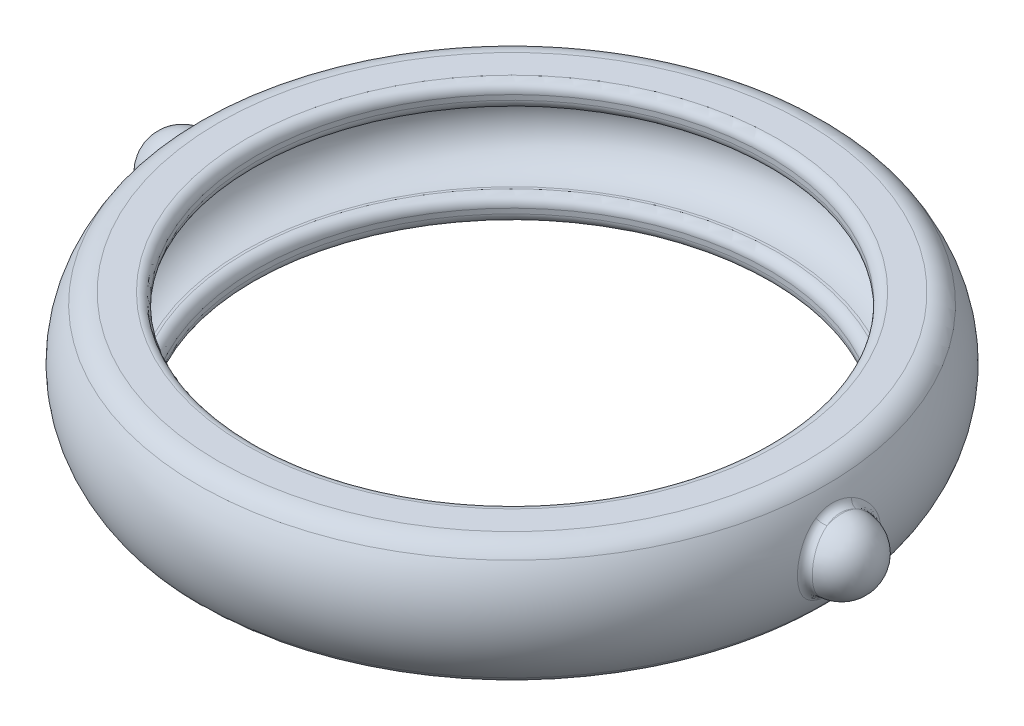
SolidWorks part; units mm, degrees
ref_plane "前视基准面" through (0, 0, 0) normal (0, 0, 1) x (1, 0, 0)
ref_plane "上视基准面" through (0, 0, 0) normal (0, 1, 0) x (1, 0, 0)
ref_plane "右视基准面" through (0, 0, 0) normal (1, 0, 0) x (0, 0, -1)
sketch "草图1" plane through (0, 0, 0) normal (0, 0, 1) x (1, 0, 0)
  line L0 (0, 18.5238) -> (0, -10.9048) construction
  line L2 (10.8, 0) -> (11.9292, 0)
  line L3 (10.4, 0.4) -> (10.4, 0.6)
  line L4 (10.8, 5) -> (11.9292, 5)
  line L6 (12.4, 5.7484) -> (12.4, -1.0538) construction
  line L7 (9.0947, 4) -> (12.7705, 4) construction
  line L8 (9.0947, 1) -> (12.7705, 1) construction
  line L9 (10.9, 5.6525) -> (10.9, -0.1978) construction
  line L10 (10.4, 4.4) -> (10.4, 4.6)
  line L11 (10.8, 4) -> (10.9, 4)
  line L12 (10.8, 1) -> (10.9, 1)
  arc A0 (10.9, 1) -> (10.9, 4) centre (10.9, 2.5) ccw
  arc A1 (12.7499, 4.5714) -> (12.7499, 0.4286) centre (9.775, 2.5) cw
  arc A2 (10.8, 0) -> (10.4, 0.4) centre (10.8, 0.4) cw
  arc A3 (10.4, 0.6) -> (10.8, 1) centre (10.8, 0.6) cw
  arc A4 (10.4, 4.4) -> (10.8, 4) centre (10.8, 4.4) ccw
  arc A5 (10.4, 4.6) -> (10.8, 5) centre (10.8, 4.6) cw
  arc A6 (12.7499, 0.4286) -> (11.9292, 0) centre (11.9292, 1) cw
  arc A7 (12.7499, 4.5714) -> (11.9292, 5) centre (11.9292, 4) ccw
  point P22 (10.4, 1)
  point P28 (10.4, 4)
  point P33 (12.4, 0)
  point P36 (12.4, 5)
  dimension "D3" = 1
  dimension "D1" = 13.4
  dimension "D2" = 0.4
  dimension "D4" = 0.5
revolve "旋转1" add sketch "草图1" angle 360 about L0
ref_plane "基准面1" through (13.4, 0, 0) normal (1, 0, 0) x (0, 0, -1)
sketch "草图4" plane through (13.4, 0, 0) normal (1, 0, 0) x (0, 0, -1)
  line L0 (-16.7, 2.5) -> (16.7, 2.5) construction
  line L1 (0, -2.5) -> (0, 2.5) construction
  line L2 (-13.4, 2.5) -> (13.4, 2.5) construction
  circle A0 centre (0, 2.5) radius 1.4
  arc A1 (-12.7499, 4.5714) -> (-12.7499, 0.4286) centre (-9.775, 2.5) ccw construction
  arc A2 (12.7499, 0.4286) -> (12.7499, 4.5714) centre (9.775, 2.5) ccw construction
  point P14 (0, 0)
  dimension "D1" = 2.8
  dimension "D2" = 0
extrude "凸台-拉伸1" add sketch "草图4" against normal up to next
sketch "草图5" plane through (13.4, 0, 0) normal (1, 0, 0) x (0, 0, -1)
  line L0 (0, 3.9) -> (0, 1.1)
  circle A0 centre (0, 2.5) radius 1.4 construction
  arc A1 (0, 1.1) -> (0, 3.9) centre (0, 2.5) ccw
revolve "旋转2" add sketch "草图5" angle 180 about L0
ref_plane "基准面2" through (-13.4, 0, 0) normal (1, 0, 0) x (0, 0, -1)
sketch "草图6" plane through (-13.4, 0, 0) normal (1, 0, 0) x (0, 0, -1)
  circle A0 centre (0, 2.5) radius 1.4 construction
  circle A1 centre (0, 2.5) radius 1.4
extrude "凸台-拉伸2" add sketch "草图6" along normal up to next
sketch "草图7" plane through (-13.4, 0, 0) normal (-1, 0, 0) x (0, 0, 1)
  line L0 (0, 1.1) -> (0, 3.9)
  circle A0 centre (0, 2.5) radius 1.4 construction
  arc A1 (0, 1.1) -> (0, 3.9) centre (0, 2.5) ccw
revolve "旋转3" add sketch "草图7" angle 180 about L0
fillet "圆角1" radius 0.35 2 edges at (-13.1887, 3.6496, 0.799) (13.2574, 3.3211, 1.134)
